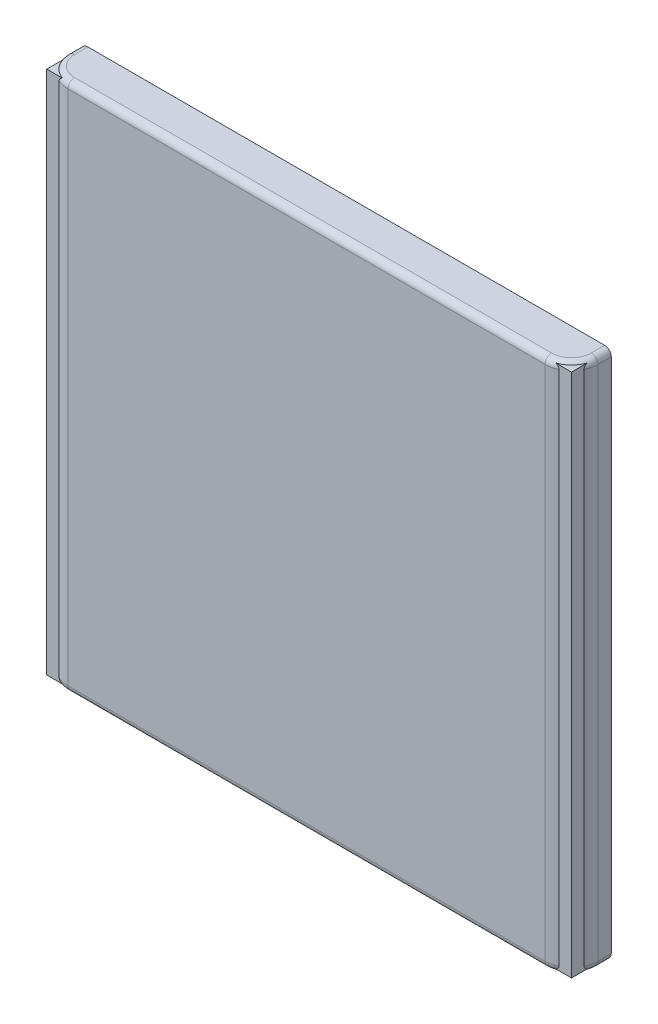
SolidWorks part; units mm, degrees
ref_plane "Plan de face" through (0, 0, 0) normal (0, 0, 1) x (1, 0, 0)
ref_plane "Plan de dessus" through (0, 0, 0) normal (0, 1, 0) x (1, 0, 0)
ref_plane "Plan de droite" through (0, 0, 0) normal (1, 0, 0) x (0, 0, -1)
sketch "Esquisse1" plane through (0, 0, 0) normal (0, 0, 1) x (1, 0, 0)
  line L1 (0, 0) -> (400, 0)
  line L2 (0, 0) -> (0, 400)
  line L3 (0, 400) -> (400, 400)
  line L4 (400, 0) -> (400, 400)
  dimension "D1" = 400
  dimension "D2" = 400
extrude "Boss.-Extru.1" add sketch "Esquisse1" along normal blind 30
shell "Coque1" thickness 2
fillet "Congé1" radius 20 2 edges at (400, 200, 30) (0, 200, 30)
fillet "Congé4" radius 5 10 edges at (400, 400, 5) (394.1421, 400, 24.1421) (0, 400, 5) (5.8579, 400, 24.1421) (200, 400, 30) (0, 0, 5) (5.8579, 0, 24.1421) (400, 0, 5) (394.1421, 0, 24.1421) (200, 0, 30)
